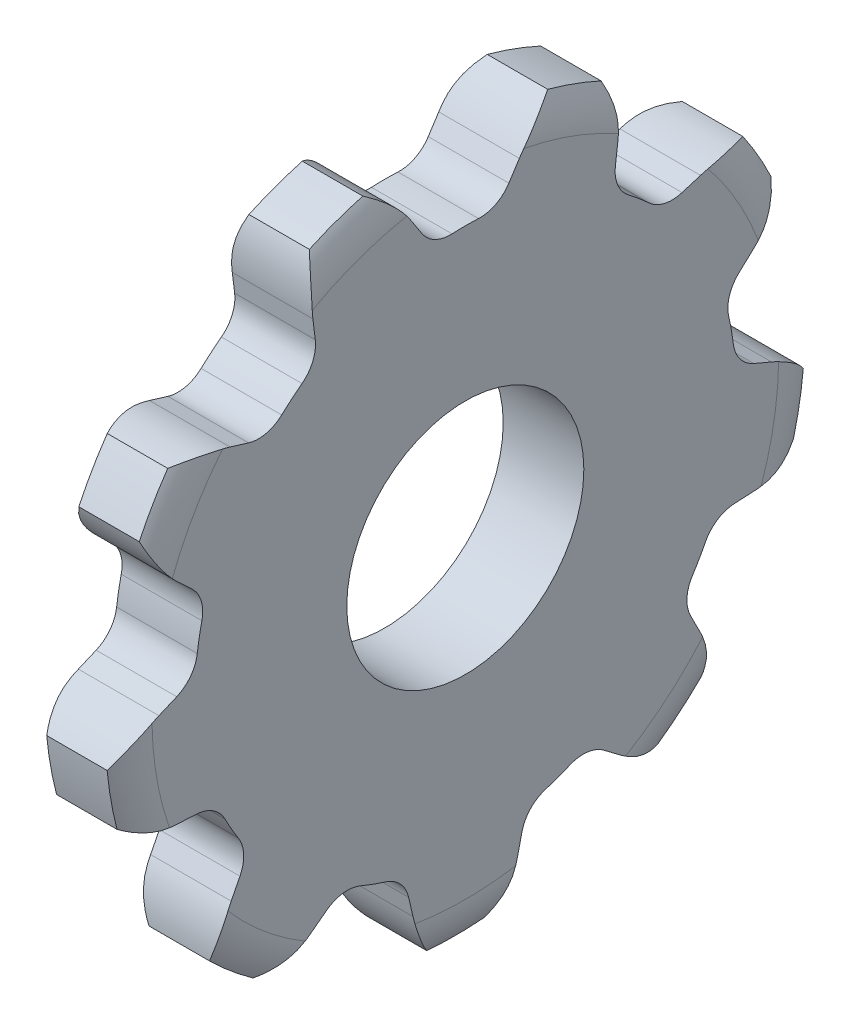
SolidWorks part; units mm, degrees
ref_plane "Plane1" through (0, 0, 0) normal (0, 0, 1) x (1, 0, 0)
ref_plane "Plane2" through (0, 0, 0) normal (0, 1, 0) x (1, 0, 0)
ref_plane "Plane3" through (0, 0, 0) normal (1, 0, 0) x (0, 0, -1)
sketch "Clipboard" plane through (0, 0, 0) normal (0, 1, 0) x (1, 0, 0)
  line L0 (0, 0) -> (22.6789, -3.592)
  line L1 (-15, 0) -> (100, 0) construction
  line L2 (0, 0) -> (-2.1039, 2.3779)
  line L3 (0, 0) -> (-11.863, 4.5341)
  line L4 (0, 0) -> (8.5297, 1.351)
  line L5 (0, 0) -> (-20.9428, -7.811)
  line L6 (0, 0) -> (-7.1589, -4.8301)
  line L7 (-2.1039, 2.3779) -> (2.7074, 24.206)
  line L8 (-76.2, 54.61) -> (-47.9044, 54.61)
  line L9 (-67.0794, 25.4907) -> (-62.6246, 26.5192)
  line L10 (-76.2, 71.12) -> (-42.6324, 71.12)
  circle A0 centre (0, 0) radius 7.9375
  circle A1 centre (0, 0) radius 25.4
  circle A2 centre (0, 0) radius 25.4
sketch "BasProSke" plane through (0, 0, 0) normal (0, 1, 0) x (1, 0, 0)
  line L0 (-10, 0) -> (60, 0) construction
  line L1 (0, 0) -> (0, 33.5676)
  line L2 (0, 0) -> (8.636, 0)
  line L3 (8.636, 0) -> (8.636, 33.5676)
  line L4 (7.5565, 37.4538) -> (1.0795, 37.4538)
  arc A0 (0, 33.5676) -> (1.0795, 37.4538) centre (7.5349, 33.5676) cw
  arc A1 (8.636, 33.5676) -> (7.5565, 37.4538) centre (1.1011, 33.5676) ccw
revolve "Base-Revolve" add sketch "BasProSke" angle 360 about L0
sketch "TooCutSke" plane through (0, 0, 0) normal (1, 0, 0) x (0, 0, -1)
  line L0 (-4.6667, 30.5715) -> (-5.7922, 32.3047)
  line L1 (0, 0) -> (0, 107) construction
  line L2 (1.1481, 0) -> (1.1481, 288.74) construction
  line L3 (4.6667, 30.5715) -> (5.7922, 32.3047)
  line L5 (1.1481, 35.3206) -> (42.4634, 8.4901) construction
  arc A0 (1.4197, 28.9104) -> (-1.4197, 28.9104) centre (0, 0) ccw
  arc A1 (1.4197, 28.9104) -> (4.6667, 30.5715) centre (1.5991, 32.5636) ccw
  arc A2 (-1.4197, 28.9104) -> (-4.6667, 30.5715) centre (-1.5991, 32.5636) cw
  circle A3 centre (0, 0) radius 33.5676 construction
  circle A4 centre (1.1481, 33.548) radius 4.572 construction
  arc A5 (5.7922, 32.3047) -> (13.6084, 37.3886) centre (15.4208, 26.0518) cw
  arc A6 (-5.7922, 32.3047) -> (-13.6084, 37.3886) centre (-15.4208, 26.0518) ccw
  arc A7 (13.6084, 37.3886) -> (-13.6084, 37.3886) centre (0, 0) ccw
extrude "ToothCut" cut sketch "TooCutSke" along normal through all
pattern_circular "TeethCuts" count 9 every 40 about axis through (-10, 0, 0) along (1, 0, 0) of "ToothCut"
sketch "HubNeaOneSke" plane through (0, 0, 0) normal (-1, 0, 0) x (0, 0, 1)
  circle A0 centre (0, 0) radius 25.4
extrude "HubNearOne" [suppressed] add sketch "HubNeaOneSke" along normal blind 13.7161
sketch "HubNeaBotSke" plane through (0, 0, 0) normal (-1, 0, 0) x (0, 0, 1)
  circle A0 centre (0, 0) radius 25.4
extrude "HubNearBoth" [suppressed] add sketch "HubNeaBotSke" along normal blind 6.858
ref_plane "FarPln" through (8.636, 0, 0) normal (1, 0, 0) x (0, 0, -1)
sketch "HubFarSke" plane through (8.636, 0, 0) normal (1, 0, 0) x (0, 0, -1)
  circle A0 centre (0, 0) radius 25.4
extrude "HubFar" [suppressed] add sketch "HubFarSke" along normal blind 6.858
sketch "BorSke" plane through (0, 0, 0) normal (1, 0, 0) x (0, 0, -1)
  circle A0 centre (0, 0) radius 12.7
extrude "Bore" cut sketch "BorSke" along normal mid plane 44.7041
sketch "KeySke" plane through (0, 0, 0) normal (1, 0, 0) x (0, 0, -1)
  line L0 (-3.175, 0) -> (-3.175, 15.5956)
  line L1 (-3.175, 15.5956) -> (3.175, 15.5956)
  line L2 (3.175, 15.5956) -> (3.175, 0)
  line L3 (0, 0) -> (0, 34) construction
  line L4 (-3.175, 0) -> (3.175, 0)
extrude "Keyway" [suppressed] cut sketch "KeySke" along normal mid plane 44.7041
pattern_circular "Keyway2" [suppressed] count 2 every 90 about axis through (-10, 0, 0) along (1, 0, 0)
equation "\"Num_teeth@Clipboard\" = int( \"Num_teeth@Clipboard\" )"
equation "\"Num_teeth@Clipboard\" = ((sgn( \"Num_teeth@Clipboard\" - 5.0)+1)*( \"Num_teeth@Clipboard\" - 5.0))/2 +5.0"
equation "' \"Num_teeth@Clipboard\" = ((sgn( \"Num_teeth@Clipboard\" - 200.0)-1)*( \"Num_teeth@Clipboard\" - 200.0))/-2 +200.0"
equation "\"OAL@Clipboard\" = \"Thickness@Clipboard\""
equation "\"Pitch_radius@Clipboard\" = ( \"Pitch@Clipboard\" / 2.0) / sin(3.14159265 / \"Num_teeth@Clipboard\" )"
equation "\"MHD@Clipboard\" =2.0 * ( \"Pitch_radius@Clipboard\" * 0.9985 -  \"H@Clipboard\" )"
equation "\"MHD@Clipboard\" = ((sgn( \"MHD@Clipboard\" - \"Hub_dia@Clipboard\" )-1)*( \"MHD@Clipboard\" - \"Hub_dia@Clipboard\" ))/-2+ \"Hub_dia@Clipboard\""
equation "\"OAL@Clipboard\" = ((sgn( \"OAL@Clipboard\" - \"Overall_len@Clipboard\" )+1)*( \"OAL@Clipboard\" - \"Overall_len@Clipboard\" ))/2 + \"Overall_len@Clipboard\" + 0.000002"
equation "\"Num_teeth@TeethCuts\" = int( \"Show_teeth@Clipboard\" ) + 1"
equation "\"Num_teeth@TeethCuts\" = ((sgn( \"Num_teeth@TeethCuts\" - \"Num_teeth@Clipboard\" )-1)*( \"Num_teeth@TeethCuts\" - \"Num_teeth@Clipboard\" ))/-2+ \"Num_teeth@Clipboard\""
equation "\"Num_teeth@TeethCuts\" = ((sgn( \"Num_teeth@TeethCuts\" - 2.0)+1)*( \"Num_teeth@TeethCuts\" - 2.0))/2 +2.0"
equation "\"Angle@TeethCuts\" = 360.0 / \"Num_teeth@Clipboard\""
equation "\"Pitch_radius@TooCutSke\" = \"Pitch_radius@Clipboard\""
equation "\"Cp@TooCutSke\" = 0.05 * \"Pitch@Clipboard\""
equation "\"Rt@TooCutSke\" = 0.5 * \"Pitch@Clipboard\""
equation "\"R@TooCutSke\"  = 0.8 * \"H@Clipboard\""
equation "\"Dr@TooCutSke\" = \"Pitch_radius@Clipboard\" * 0.9985 -  \"H@Clipboard\""
equation "\"Ag@TooCutSke\" =  2.0 * \"Ap@Clipboard\" + 360.0 / \"Num_teeth@Clipboard\""
equation "\"L@TooCutSke\" = 0.01 * \"Pitch@Clipboard\" * \"Num_teeth@Clipboard\""
equation "\"H@TooCutSke\" = \"H@Clipboard\""
equation "\"Angle@TooCutSke\" =  360.0 / \"Num_teeth@Clipboard\""
equation "\"Diameter@BasProSke\" = 2.0 * \"Pitch_radius@Clipboard\"  + 1.7 * \"H@Clipboard\""
equation "\"Thickness@BasProSke\"  = \"Thickness@Clipboard\""
equation "\"G1@BasProSke\" =  \"Thickness@Clipboard\" * 0.125"
equation "\"G2@BasProSke\" =   \"Thickness@Clipboard\" * 0.125"
equation "\"H1@BasProSke\" =  \"Diameter@BasProSke\" / 2.0 - \"Pitch_radius@Clipboard\""
equation "\"H2@BasProSke\" =  \"Diameter@BasProSke\" / 2.0 - \"Pitch_radius@Clipboard\""
equation "\"Diameter@HubNeaOneSke\" = \"MHD@Clipboard\""
equation "\"Length@HubNearOne\" = \"OAL@Clipboard\" - \"Thickness@BasProSke\""
equation "\"Diameter@HubNeaBotSke\" = \"MHD@Clipboard\""
equation "\"Length@HubNearBoth\" = ( \"OAL@Clipboard\" - \"Thickness@BasProSke\" ) / 2.0"
equation "\"Thickness@FarPln\" = \"Thickness@BasProSke\""
equation "\"Diameter@HubFarSke\" = \"MHD@Clipboard\""
equation "\"Length@HubFar\" = ( \"OAL@Clipboard\" - \"Thickness@BasProSke\" ) / 2.0"
equation "\"D1@Bore\" = \"OAL@Clipboard\" * 2.0"
equation "\"D1@Keyway\" = \"OAL@Clipboard\" * 2.0"
equation "\"Offset@KeySke\" = \"T_dim@Clipboard\" - \"Diameter@BorSke\" / 2.0"
